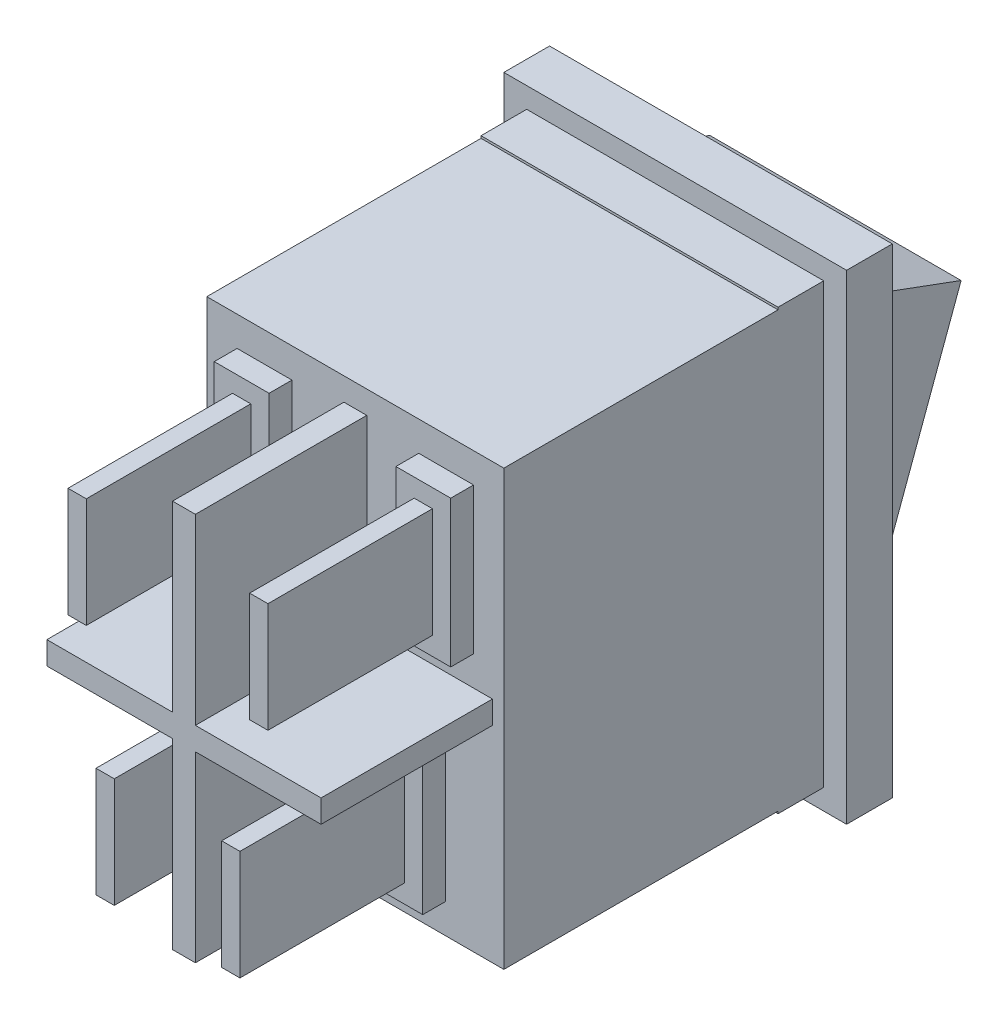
SolidWorks part; units mm, degrees
ref_plane "Спереди" through (0, 0, 0) normal (0, 0, 1) x (1, 0, 0)
ref_plane "Сверху" through (0, 0, 0) normal (0, 1, 0) x (1, 0, 0)
ref_plane "Справа" through (0, 0, 0) normal (1, 0, 0) x (0, 0, -1)
sketch "Эскиз1" plane through (0, 0, 0) normal (0, 0, 1) x (1, 0, 0)
  line L1 (6.5, 9.5) -> (-6.5, 9.5)
  line L2 (6.5, 9.5) -> (6.5, -9.5)
  line L3 (6.5, -9.5) -> (-6.5, -9.5)
  line L4 (-6.5, 9.5) -> (-6.5, -9.5)
extrude "Бобышка-Вытянуть1" add sketch "Эскиз1" along normal blind 14
sketch "Эскиз2" plane through (0, 0, 0) normal (0, 0, -1) x (-1, 0, 0)
  line L1 (-7.5, 10.5) -> (7.5, 10.5)
  line L2 (-7.5, 10.5) -> (-7.5, -10.5)
  line L3 (-7.5, -10.5) -> (7.5, -10.5)
  line L4 (7.5, 10.5) -> (7.5, -10.5)
extrude "Бобышка-Вытянуть2" add sketch "Эскиз2" along normal blind 2
sketch "Эскиз3" plane through (0, 0, -2) normal (0, 0, -1) x (-1, 0, 0)
  line L1 (-5.5, 8) -> (5.5, 8)
  line L2 (-5.5, 8) -> (-5.5, -8)
  line L3 (-5.5, -8) -> (5.5, -8)
  line L4 (5.5, 8) -> (5.5, -8)
extrude "Вырез-Вытянуть1" cut sketch "Эскиз3" against normal blind 13
sketch3d "3DSketch1"
  line L0 (0, -8, -2) -> (0, 5.6059, -7.0129)
  line L2 (5.5, -8, -2) -> (-5.5, -8, -2) construction
  line L3 (0, 5.6059, -7.0129) -> (0, 8.3816, 0.5209)
  line L4 (0, 8.3816, 0.5209) -> (0, -5.2243, 5.5337)
  line L5 (0, -8, -2) -> (0, -5.2243, 5.5337)
extrude "Boss-Extrude1" add sketch "3DSketch1" along direction (-1, 0, 0) on the side of the normal blind 5.5 and the other way blind 5.5 separate body
sketch "Sketch2" plane through (0, 0, 14) normal (0, 0, 1) x (1, 0, 0)
  line L0 (-6, 0.5) -> (-0.5, 0.5)
  line L1 (-6, 0.5) -> (-6, -0.5)
  line L2 (-6, -0.5) -> (-0.5, -0.5)
  line L3 (-0.5, -0.5) -> (-0.5, -8.5)
  line L4 (-0.5, -8.5) -> (0.5, -8.5)
  line L5 (0.5, -8.5) -> (0.5, -0.5)
  line L6 (0.5, -0.5) -> (6, -0.5)
  line L7 (6, -0.5) -> (6, 0.5)
  line L8 (6, 0.5) -> (0.5, 0.5)
  line L9 (0.5, 0.5) -> (0.5, 8.5)
  line L10 (0.5, 8.5) -> (-0.5, 8.5)
  line L11 (-0.5, 8.5) -> (-0.5, 0.5)
extrude "Boss-Extrude2" add sketch "Sketch2" along normal blind 7.5
sketch "Sketch3" plane through (0, 0, 14) normal (0, 0, 1) x (1, 0, 0)
  line L1 (-4.375, 7.4) -> (-3.575, 7.4)
  line L2 (-4.375, 7.4) -> (-4.375, 2.6)
  line L3 (-4.375, 2.6) -> (-3.575, 2.6)
  line L4 (-3.575, 7.4) -> (-3.575, 2.6)
  line L5 (3.575, 7.4) -> (4.375, 7.4)
  line L6 (3.575, 7.4) -> (3.575, 2.6)
  line L7 (3.575, 2.6) -> (4.375, 2.6)
  line L8 (4.375, 7.4) -> (4.375, 2.6)
  line L9 (-3.15, -2.6) -> (-2.35, -2.6)
  line L10 (-3.15, -2.6) -> (-3.15, -7.4)
  line L11 (-3.15, -7.4) -> (-2.35, -7.4)
  line L12 (-2.35, -2.6) -> (-2.35, -7.4)
  line L13 (3.15, -2.6) -> (2.35, -2.6)
  line L14 (3.15, -2.6) -> (3.15, -7.4)
  line L15 (3.15, -7.4) -> (2.35, -7.4)
  line L16 (2.35, -2.6) -> (2.35, -7.4)
extrude "Boss-Extrude3" add sketch "Sketch3" along normal blind 8.2 separate body
sketch "Sketch4" plane through (0, 0, 14) normal (0, 0, 1) x (1, 0, 0)
  line L0 (-5.175, 8.2) -> (-2.775, 8.2)
  line L1 (-2.775, 8.2) -> (-2.775, 1.8)
  line L2 (-2.775, 1.8) -> (-5.175, 1.8)
  line L3 (-5.175, 1.8) -> (-5.175, 8.2)
  line L5 (2.775, 8.2) -> (5.175, 8.2)
  line L6 (2.775, 8.2) -> (2.775, 1.8)
  line L7 (2.775, 1.8) -> (5.175, 1.8)
  line L8 (5.175, 8.2) -> (5.175, 1.8)
  line L9 (-3.95, -1.8) -> (-1.55, -1.8)
  line L10 (-3.95, -1.8) -> (-3.95, -8.2)
  line L11 (-3.95, -8.2) -> (-1.55, -8.2)
  line L12 (-1.55, -1.8) -> (-1.55, -8.2)
  line L13 (1.55, -1.8) -> (3.95, -1.8)
  line L14 (1.55, -1.8) -> (1.55, -8.2)
  line L15 (1.55, -8.2) -> (3.95, -8.2)
  line L16 (3.95, -1.8) -> (3.95, -8.2)
extrude "Boss-Extrude4" add sketch "Sketch4" along normal blind 1
sketch "Sketch5" plane through (0, 0, 0) normal (0, 0, 1) x (1, 0, 0)
  line L1 (-6.5, 9.5) -> (6.5, 9.5)
  line L2 (-6.5, 9.5) -> (-6.5, 9.6)
  line L3 (-6.5, 9.6) -> (6.5, 9.6)
  line L4 (6.5, 9.5) -> (6.5, 9.6)
  line L5 (-6.5, -9.5) -> (6.5, -9.5)
  line L6 (-6.5, -9.5) -> (-6.5, -9.6)
  line L7 (-6.5, -9.6) -> (6.5, -9.6)
  line L8 (6.5, -9.5) -> (6.5, -9.6)
extrude "Boss-Extrude5" add sketch "Sketch5" along normal blind 2
